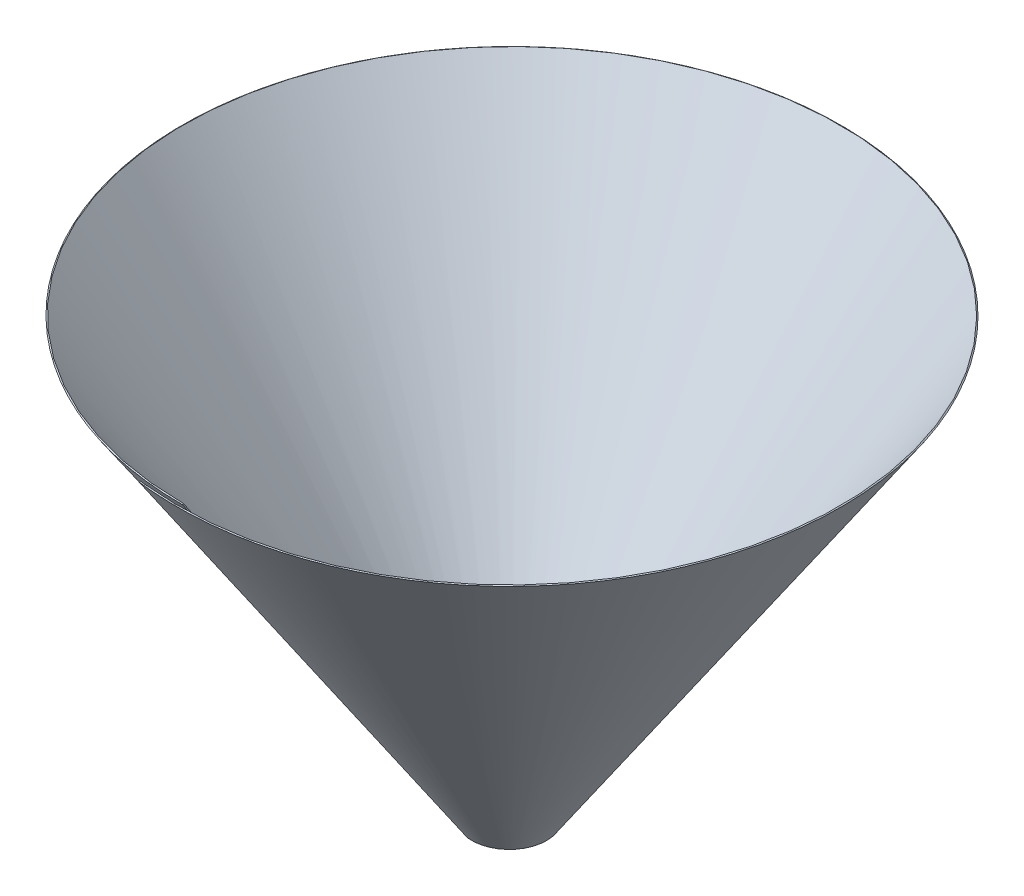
SolidWorks part; units mm, degrees
ref_plane "Ebene vorne" through (0, 0, 0) normal (0, 0, 1) x (1, 0, 0)
ref_plane "Ebene oben" through (0, 0, 0) normal (0, 1, 0) x (1, 0, 0)
ref_plane "Ebene rechts" through (0, 0, 0) normal (1, 0, 0) x (0, 0, -1)
ref_plane "Ebene1" through (0, -100, 0) normal (0, 1, 0) x (-1, 0, 0)
sketch "Skizze1" plane through (0, 0, 0) normal (0, 1, 0) x (1, 0, 0)
  circle A0 centre (0, 0) radius 75
  dimension "D1" = 150
curve "Spirale/Helix1"
sheet metal parameters "Blech1" thickness 0.25 parameters "D1"=4, "Dicke"=0.25
sketch "Skizze5" plane through (0, 0, 0) normal (0, 1, 0) x (1, 0, 0)
  spline S1 degree 3 number of poles 66 (0, -75) -> (-9.5342, -75.4712)
  spline S2 degree 3 number of poles 66 (0, -75) -> (-9.5342, -75.4712)
  dimension "D1" = 0
sketch "Skizze7" plane through (0, -100, 0) normal (0, 1, 0) x (-1, 0, 0)
  circle A0 centre (0, 0) radius 7.5
  dimension "D1" = 15
curve "Spirale/Helix2"
sketch "Skizze8" plane through (0, -100, 0) normal (0, 1, 0) x (-1, 0, 0)
  spline S2 degree 3 poles (2799.9464, -1045.974) (-143.1212, -190.2379) (-28.9841, 19.6666) (3.8896, 6.5946) (4.7567, 6.0289) (6.2074, 4.5961) (6.7903, 3.7294) (7.5739, 1.8277) (7.7742, 0.7933) (7.7536, -1.2813) (7.5327, -2.3207) (6.6973, -4.2394) (6.0832, -5.1178) (4.5526, -6.5708) (3.6367, -7.1449) (1.6438, -7.892) (0.5676, -8.0647) (-1.5767, -7.9745) (-2.6439, -7.7116) (-4.5993, -6.7844) (-5.4867, -6.1205) (-6.9374, -4.4907) (-7.5001, -3.5253) (-8.2058, -1.4418) (-8.3485, -0.3244) (-8.1843, 1.8872) (-7.8773, 2.9805) (-6.8552, 4.9688) (-6.1405, 5.8628) (-4.41, 7.3063) (-3.3951, 7.8551) (33.055, 18.9127) (143.5054, -202.7095) (-2786.7436, -1073.8926) knots -2.062967 -2.062967 -2.062967 -2.062967 0.0625 0.0625 0.125 0.125 0.1875 0.1875 0.25 0.25 0.3125 0.3125 0.375 0.375 0.4375 0.4375 0.5 0.5 0.5625 0.5625 0.625 0.625 0.6875 0.6875 0.75 0.75 0.8125 0.8125 0.875 0.875 0.9375 0.9375 2.971269 2.971269 2.971269 2.971269 only from (0, 7.5) to (1.0742, 8.5034)
  spline S3 degree 3 poles (0, 7.5) (1.0014, 7.5223) (2.0115, 7.3414) (3.8896, 6.5946) (4.7567, 6.0289) (6.2074, 4.5961) (6.7903, 3.7294) (7.5739, 1.8277) (7.7742, 0.7933) (7.7536, -1.2813) (7.5327, -2.3207) (6.6973, -4.2394) (6.0832, -5.1178) (4.5526, -6.5708) (3.6367, -7.1449) (1.6438, -7.892) (0.5676, -8.0647) (-1.5767, -7.9745) (-2.6439, -7.7116) (-4.5993, -6.7844) (-5.4867, -6.1205) (-6.9374, -4.4907) (-7.5001, -3.5253) (-8.2058, -1.4418) (-8.3485, -0.3244) (-8.1843, 1.8872) (-7.8773, 2.9805) (-6.8552, 4.9688) (-6.1405, 5.8628) (-4.41, 7.3063) (-3.3951, 7.8551) (-1.2216, 8.5145) (-0.0639, 8.6247) (1.0742, 8.5034) knots 0 0 0 0 0.0625 0.0625 0.125 0.125 0.1875 0.1875 0.25 0.25 0.3125 0.3125 0.375 0.375 0.4375 0.4375 0.5 0.5 0.5625 0.5625 0.625 0.625 0.6875 0.6875 0.75 0.75 0.8125 0.8125 0.875 0.875 0.9375 0.9375 1 1 1 1
  dimension "D1" = 0
lofted bend "Ausgeformte Biegungen8" parameters "D1"=0, "D12"=0.25
other "Freiform-Biegung2" parameters "D1"=1000, "D4"=57.296, "D5"=1
flat pattern "Abwicklung2"
sketch "Biegung-Linien2" plane through (0.2087, -34.7785, 51.5237) normal (-0.0034, 0.5595, -0.8288) x (-1, -0.0019, 0.0028)
  line L0 (0.2087, 41.9605) -> (0.2087, -78.6888) construction
  line L1 (15.2146, 41.1375) -> (1.7248, -78.7553) construction
  line L2 (30.0537, 38.641) -> (3.2427, -78.9936) construction
  line L3 (44.5271, 34.499) -> (4.7304, -79.403) construction
  line L4 (58.4513, 28.7588) -> (6.1697, -79.977) construction
  line L5 (71.6531, 21.4965) -> (7.5421, -80.711) construction
  line L6 (83.9657, 12.7999) -> (8.8318, -81.5944) construction
  line L7 (95.2337, 2.7769) -> (10.0142, -82.6272) construction
  line L8 (105.3121, -8.4503) -> (11.0798, -83.7888) construction
  line L9 (114.0782, -20.7374) -> (12.0203, -85.0628) construction
  line L10 (121.4187, -33.9334) -> (12.8071, -86.4449) construction
  line L11 (127.2405, -47.8734) -> (13.4338, -87.9134) construction
  line L12 (131.4744, -62.3821) -> (13.902, -89.4467) construction
  line L13 (134.0551, -77.2811) -> (14.1975, -91.0297) construction
  line L14 (134.9547, -92.3817) -> (14.3078, -92.6427) construction
  line L15 (134.1643, -107.4954) -> (14.2397, -94.2645) construction
  line L16 (131.6782, -122.431) -> (13.9907, -95.8754) construction
  line L17 (127.5424, -137.0029) -> (13.564, -97.4557) construction
  line L18 (121.7997, -151.0268) -> (12.9551, -98.9823) construction
  line L19 (114.525, -164.3287) -> (12.1787, -100.4383) construction
  line L20 (105.7978, -176.7343) -> (11.2396, -101.8032) construction
  line L21 (95.7349, -188.0917) -> (10.1545, -103.0645) construction
  line L22 (84.4631, -198.2602) -> (8.9223, -104.1922) construction
  line L23 (72.1196, -207.1086) -> (7.5704, -105.1843) construction
  line L24 (58.8583, -214.5249) -> (6.1104, -106.0229) construction
  line L25 (44.8455, -220.4171) -> (4.5586, -106.6932) construction
  line L26 (30.2543, -224.7044) -> (2.9349, -107.1864) construction
  line L27 (15.2685, -227.3347) -> (1.2609, -107.5044) construction
  line L28 (0.0759, -228.2768) -> (-0.4454, -107.634) construction
  line L29 (-15.1334, -227.5091) -> (-2.1617, -107.5595) construction
  line L30 (-30.1681, -225.0446) -> (-3.8657, -107.2964) construction
  line L31 (-44.8393, -220.913) -> (-5.5369, -106.8457) construction
  line L32 (-58.9514, -215.1693) -> (-7.1409, -106.2109) construction
other "Abwickeln-<Freiform-Biegung2>1"
